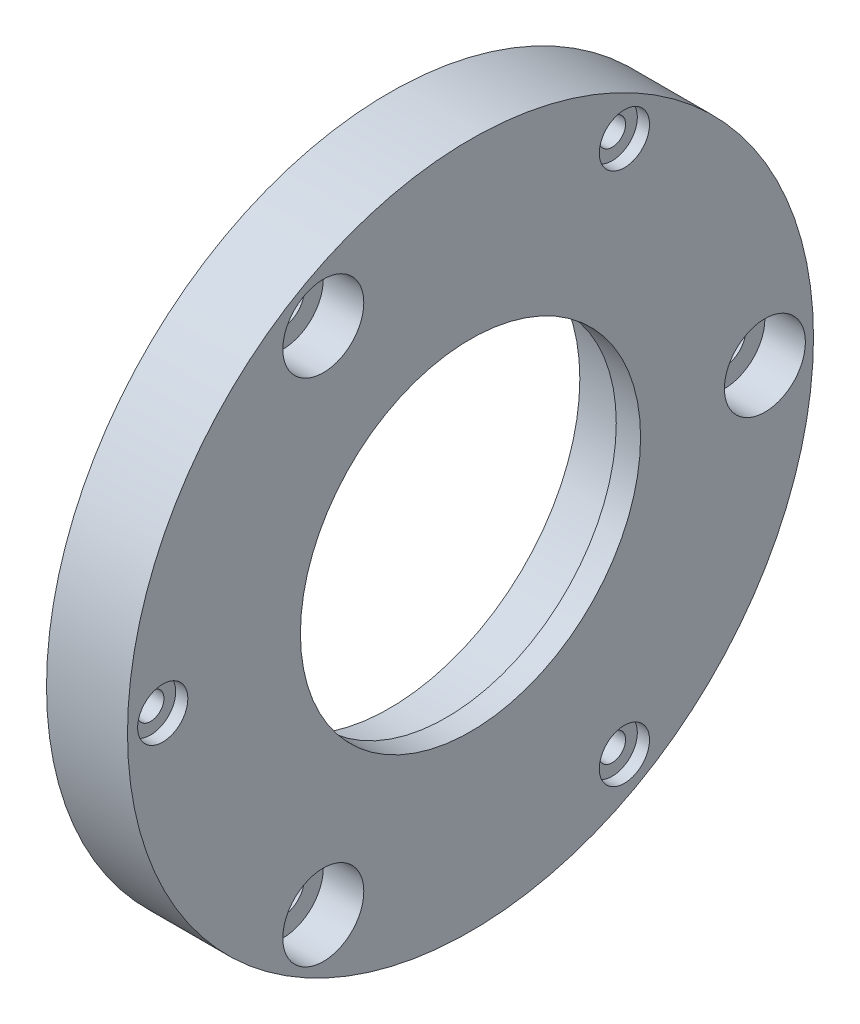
SolidWorks part; units mm, degrees
ref_plane "Front Plane" through (0, 0, 0) normal (0, 0, 1) x (1, 0, 0)
ref_plane "Top Plane" through (0, 0, 0) normal (0, 1, 0) x (1, 0, 0)
ref_plane "Right Plane" through (0, 0, 0) normal (1, 0, 0) x (0, 0, -1)
sketch "Sketch1" plane through (0, 0, 0) normal (1, 0, 0) x (0, 0, -1)
  circle A0 centre (0, 0) radius 42.35
  dimension "D1" = 84.7
extrude "Boss-Extrude1" add sketch "Sketch1" along normal blind 10
sketch "Sketch2" plane through (0, 0, 0) normal (-1, 0, 0) x (0, 0, 1)
  circle A0 centre (0, 0) radius 23.5
  dimension "D1" = 47
extrude "Cut-Extrude1" cut sketch "Sketch2" against normal blind 7
sketch "Sketch3" plane through (7, 0, 0) normal (-1, 0, 0) x (0, 0, 1)
  circle A0 centre (0, 0) radius 21
  dimension "D1" = 42
extrude "Cut-Extrude2" cut sketch "Sketch3" against normal up to next
hole_wizard "CBORE for M5 SHCS1" positions "Sketch5" profile "Sketch4" counterbore size "M5" standard "Ansi Metric"
sketch "Sketch5" plane through (10, 0, 0) normal (1, 0, 0) x (0, 0, -1)
  point P0 (36.35, 0)
  dimension "D1" = 36.35
sketch "Sketch4" plane through (10, 0, -36.35) normal (0, 1, 0) x (0, 0, -1)
  line L0 (0, 0) -> (0, 10)
  line L1 (0, 10) -> (2.65, 10)
  line L3 (2.65, 10) -> (2.65, 5)
  line L4 (2.65, 5) -> (5, 5)
  line L5 (5, 5) -> (5, 0)
  line L7 (5, 0) -> (0, 0)
  line L11 (0, -6.35) -> (0, 107.95) construction
  dimension "Thru Hole Dia." = 5.3
  dimension "Thru Hole Depth" = 10
  dimension "C'Bore Dia." = 10
  dimension "C'Bore Depth" = 5
pattern_circular "CirPattern1" count 3 over 360 about axis through (0, 0, 0) along (1, 0, 0) of "CBORE for M5 SHCS1"
sketch "Sketch6" plane through (10, 0, 0) normal (1, 0, 0) x (0, 0, -1)
  circle A0 centre (-38, 0) radius 3.1
  dimension "D1" = 38
extrude "Cut-Extrude3" cut sketch "Sketch6" against normal blind 1.5
hole_wizard "M4x0.7 Tapped Hole1" positions "Sketch8" profile "Sketch7" tap size "M4x0.7" standard "Ansi Metric"
sketch "Sketch8" plane through (8.5, 0, 0) normal (1, 0, 0) x (0, 0, -1)
  circle A0 centre (-38, 0) radius 3.1 construction
  point P0 (-38, 0)
sketch "Sketch7" plane through (8.5, 0, 38) normal (0, 1, 0) x (0, 0, -1)
  line L0 (0, 0) -> (0, 8.5)
  line L1 (0, 8.5) -> (1.65, 8.5)
  line L2 (1.65, 8.5) -> (1.65, 0)
  line L5 (1.65, 0) -> (0, 0)
  line L11 (0, -6.35) -> (0, 107.95) construction
  dimension "Thru Tap Drill Dia." = 3.3
  dimension "Thru Tap Drill Depth" = 8.5
pattern_circular "CirPattern2" count 3 over 360 about axis through (0, 0, 0) along (1, 0, 0) of "Cut-Extrude3", "M4x0.7 Tapped Hole1"
